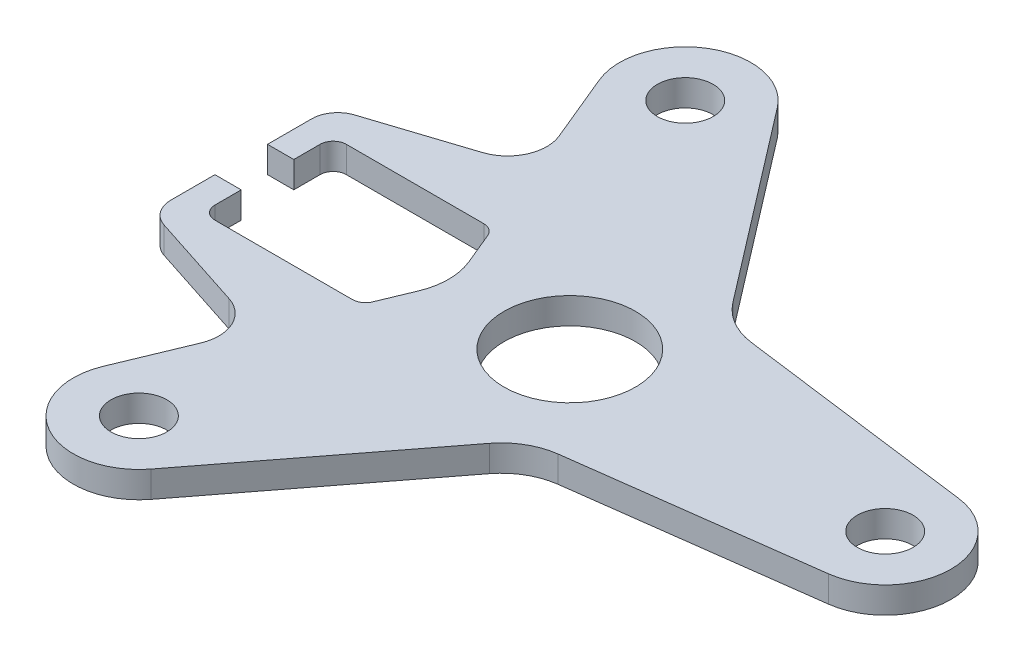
SolidWorks part; units mm, degrees
ref_plane "Plan de face" through (0, 0, 0) normal (0, 0, 1) x (1, 0, 0)
ref_plane "Plan de dessus" through (0, 0, 0) normal (0, 1, 0) x (1, 0, 0)
ref_plane "Plan de droite" through (0, 0, 0) normal (1, 0, 0) x (0, 0, -1)
sketch "Esquisse1" plane through (0, 0, 0) normal (0, 1, 0) x (1, 0, 0)
  line L0 (24.6526, 4.9572) -> (6.4547, 7.353)
  line L1 (0, 0) -> (24, 0) construction
  line L2 (24.6526, -4.9572) -> (6.4547, -7.353)
  line L3 (-8.0332, -23.8284) -> (3.1406, -9.2664)
  line L4 (-16.6194, -18.8712) -> (-14.4494, -13.6322)
  line L5 (-16.6194, 18.8712) -> (-14.4494, 13.6322)
  line L6 (-8.0332, 23.8284) -> (3.1406, 9.2664)
  line L7 (-10.6181, -4.3827) -> (-9.5953, -1.9134)
  line L8 (-23.618, 7.2513) -> (-16.2939, 9.631)
  line L9 (-25, 5.3492) -> (-25, 2)
  line L10 (-23.618, -7.2513) -> (-16.2939, -9.631)
  line L11 (-10.6181, 4.3827) -> (-9.5953, 1.9134)
  line L12 (-22, 5) -> (-11.5419, 5)
  line L13 (-23, 4) -> (-23, 2)
  line L14 (-22, -5) -> (-11.5419, -5)
  line L15 (-23, -2) -> (-23, -4)
  line L16 (-25, 2) -> (-23, 2)
  line L18 (-25, -2) -> (-23, -2)
  line L19 (-25, -2) -> (-25, -5.3492)
  arc A0 (24.6526, -4.9572) -> (24.6526, 4.9572) centre (24, 0) ccw
  circle A1 centre (24, 0) radius 2.125
  arc A2 (-16.6194, -18.8712) -> (-8.0332, -23.8284) centre (-12, -20.7846) ccw
  circle A3 centre (-12, -20.7846) radius 2.125
  arc A4 (-8.0332, 23.8284) -> (-16.6194, 18.8712) centre (-12, 20.7846) ccw
  circle A5 centre (-12, 20.7846) radius 2.125
  arc A6 (6.4547, -7.353) -> (3.1406, -9.2664) centre (7.1073, -12.3103) ccw
  arc A7 (-9.5953, -1.9134) -> (-9.5953, 1.9134) centre (-14.2147, 0) ccw
  arc A8 (3.1406, 9.2664) -> (6.4547, 7.353) centre (7.1073, 12.3103) ccw
  arc A9 (-16.2939, -9.631) -> (-14.4494, -13.6322) centre (-17.221, -12.4842) cw
  arc A10 (-23.618, 7.2513) -> (-25, 5.3492) centre (-23, 5.3492) ccw
  arc A11 (-11.5419, 5) -> (-10.6181, 4.3827) centre (-11.5419, 4) cw
  arc A12 (-10.6181, -4.3827) -> (-11.5419, -5) centre (-11.5419, -4) cw
  arc A13 (-22, -5) -> (-23, -4) centre (-22, -4) cw
  arc A14 (-22, 5) -> (-23, 4) centre (-22, 4) ccw
  arc A15 (-16.2939, 9.631) -> (-14.4494, 13.6322) centre (-17.221, 12.4842) ccw
  arc A16 (-23.618, -7.2513) -> (-25, -5.3492) centre (-23, -5.3492) cw
  circle A17 centre (0, 0) radius 5
  point P41 (-10.8738, 5)
  point P44 (-10.8738, -5)
  dimension "D2" = 4.25
  dimension "D3" = 5
  dimension "D8" = 5
  dimension "D9" = 2
  dimension "D15" = 1
  dimension "D10" = 3
  dimension "D17" = 10
  dimension "D1" = 24
  dimension "D5" = 15
  dimension "D6" = 24
  dimension "D7" = 24
  dimension "D11" = 10
  dimension "D12" = 2
  dimension "D13" = 25
  dimension "D14" = 4
  dimension "D16" = 36
  dimension "D4" = 3
extrude "Boss.-Extru.1" add sketch "Esquisse1" along normal mid plane 2
